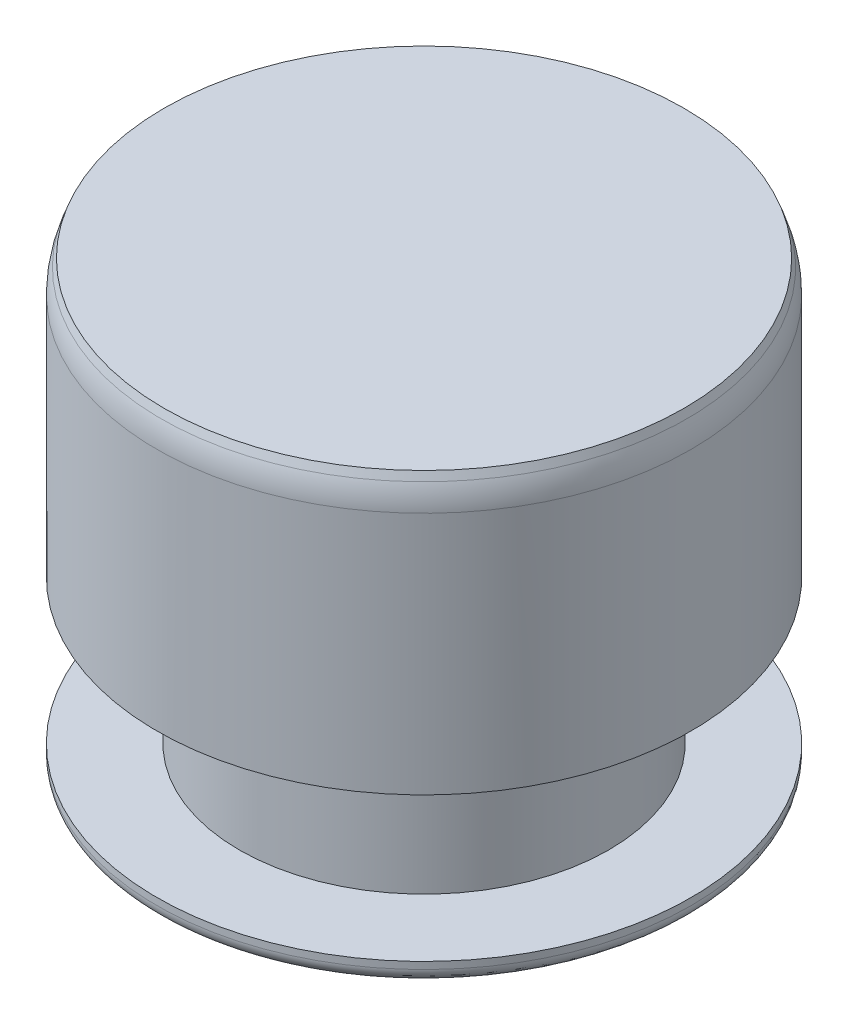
SolidWorks part; units mm, degrees
ref_plane "X_Y" through (0, 0, 0) normal (0, 0, 1) x (1, 0, 0)
ref_plane "Z_X" through (0, 0, 0) normal (0, 1, 0) x (1, 0, 0)
ref_plane "Y_Z" through (0, 0, 0) normal (1, 0, 0) x (0, 0, -1)
sketch "Sketch1" plane through (0, 0, 0) normal (0, 0, 1) x (1, 0, 0)
  line L0 (0, 0) -> (0, -8.0113)
  line L2 (0.5, -8.0113) -> (3.76, -6.1292)
  line L3 (3.76, -6.1292) -> (3.76, -5.915)
  line L4 (3.76, -5.915) -> (2.6, -5.915)
  line L5 (2.6, -5.915) -> (2.6, -3.885)
  line L6 (2.6, -3.885) -> (3.76, -3.885)
  line L7 (3.76, -3.885) -> (3.76, -0.2747)
  line L8 (3.66, 0) -> (0, 0)
  line L9 (0.5, -8.0113) -> (0, -8.0113)
  line L10 (3.66, 0) -> (3.76, -0.2747)
  line L11 (0, -0.5526) -> (0, -50000.5526) construction
  point P10 (0, -8.3)
  point P12 (2.6, -4.9)
  dimension "D1" = 6.1292
  dimension "D2" = 7.52
  dimension "D3" = 120
  dimension "D4" = 0.2142
  dimension "D5" = 2.03
  dimension "D6" = 5.2
  dimension "D7" = 0.5
  dimension "D8" = 0.1
  dimension "D9" = 20
  dimension "D10" = 8.3
  dimension "D11" = 4.9
revolve "Revolve1" add sketch "Sketch1" angle 360 about L0
fillet "Fillet1" radius 0.2 1 edges at (-3.76, -6.1292, 0)
fillet "Fillet2" radius 1 1 edges at (-3.76, -0.2747, 0)
